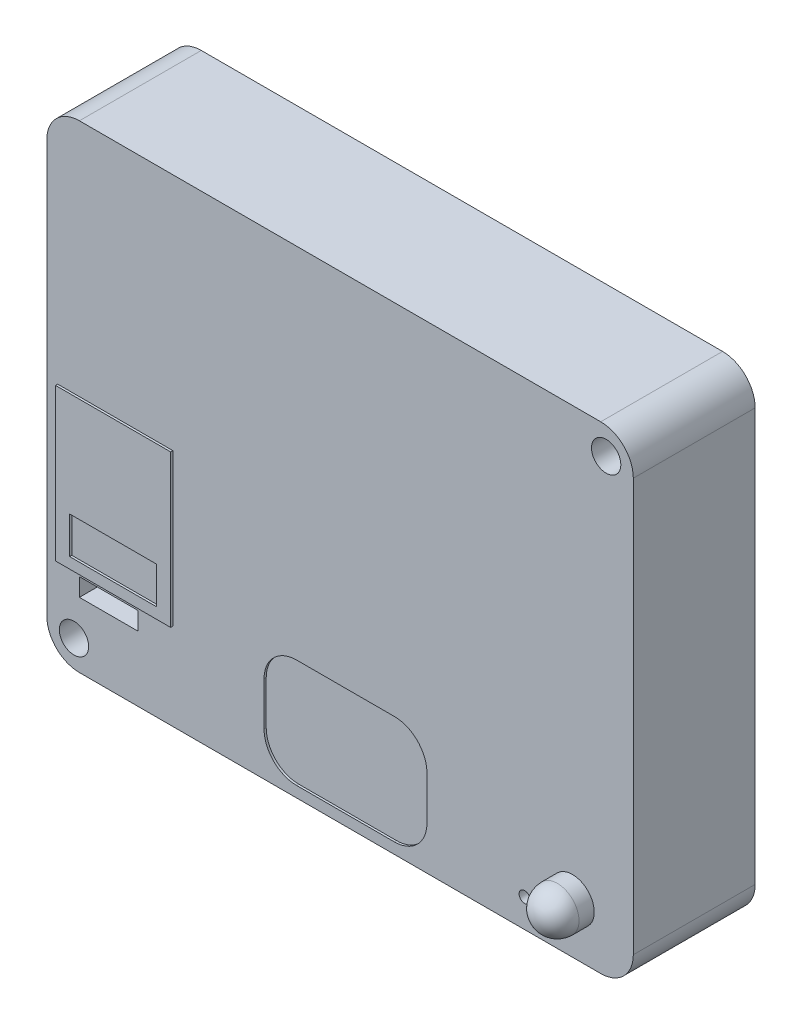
SolidWorks part; units mm, degrees
ref_plane "Front" through (0, 0, 0) normal (0, 0, 1) x (1, 0, 0)
ref_plane "Top" through (0, 0, 0) normal (0, 1, 0) x (1, 0, 0)
ref_plane "Right" through (0, 0, 0) normal (1, 0, 0) x (0, 0, -1)
sketch "Sketch1" plane through (0, 0, 0) normal (0, 0, 1) x (1, 0, 0)
  line L1 (-49.1448, -27.231) -> (19.4352, -27.231)
  line L2 (-49.1448, -27.231) -> (-49.1448, 28.649)
  line L3 (-49.1448, 28.649) -> (19.4352, 28.649)
  line L4 (19.4352, -27.231) -> (19.4352, 28.649)
  dimension "D1" = 68.58
  dimension "D2" = 55.88
extrude "Base-Extrude" add sketch "Sketch1" along normal blind 14.5034
sketch "Sketch2" plane through (0, 0, 14.5034) normal (0, 0, 1) x (1, 0, 0)
  line L0 (19.4352, -27.231) -> (19.4352, 28.649) construction
  line L1 (19.4352, 28.649) -> (-49.1448, 28.649) construction
  line L2 (-49.1448, -27.231) -> (19.4352, -27.231) construction
  line L3 (-49.1448, 28.649) -> (-49.1448, -27.231) construction
  circle A0 centre (16.2602, 25.474) radius 1.7145
  circle A1 centre (-45.9698, -24.056) radius 1.7145
  dimension "D5" = 3.429
  dimension "D6" = 3.429
  dimension "D1" = 3.175
  dimension "D2" = 3.175
  dimension "D3" = 3.175
  dimension "D4" = 3.175
extrude "Cut-Extrude1" cut sketch "Sketch2" against normal up to vertex
sketch "Sketch3" plane through (0, 0, 14.5034) normal (0, 0, 1) x (1, 0, 0)
  line L0 (-49.1448, -27.231) -> (19.4352, -27.231) construction
  line L1 (-23.7448, -13.261) -> (-4.6948, -13.261)
  line L2 (-23.7448, -13.261) -> (-23.7448, -25.961)
  line L3 (-23.7448, -25.961) -> (-4.6948, -25.961)
  line L4 (-4.6948, -13.261) -> (-4.6948, -25.961)
  line L5 (19.4352, -27.231) -> (19.4352, 28.649) construction
  dimension "D1" = 19.05
  dimension "D2" = 12.7
  dimension "D3" = 1.27
  dimension "D4" = 24.13
extrude "Cut-Extrude2" cut sketch "Sketch3" against normal blind 0.508
sketch "Sketch4" plane through (0, 0, 14.5034) normal (0, 0, 1) x (1, 0, 0)
  line L0 (-49.1448, -27.231) -> (19.4352, -27.231) construction
  line L1 (19.4352, -27.231) -> (19.4352, 28.649) construction
  circle A0 centre (6.7352, -23.929) radius 0.6553
  dimension "D1" = 3.302
  dimension "D2" = 12.7
extrude "Cut-Extrude3" cut sketch "Sketch4" against normal blind 6.35
sketch "Sketch5" plane through (0, 0, 14.5034) normal (0, 0, 1) x (1, 0, 0)
  line L0 (-49.1448, 28.649) -> (-49.1448, -27.231) construction
  line L1 (-45.3348, -17.5155) -> (-38.4768, -17.5155)
  line L2 (-45.3348, -17.5155) -> (-45.3348, -19.611)
  line L3 (-45.3348, -19.611) -> (-38.4768, -19.611)
  line L4 (-38.4768, -17.5155) -> (-38.4768, -19.611)
  line L5 (-49.1448, -27.231) -> (19.4352, -27.231) construction
  dimension "D1" = 3.81
  dimension "D2" = 6.858
  dimension "D3" = 2.0955
  dimension "D4" = 7.62
extrude "Cut-Extrude4" cut sketch "Sketch5" against normal blind 6.35
fillet "Fillet1" radius 3.81
chamfer "Chamfer3" distance 0.254 angle 45
fillet "Fillet12" radius 3.81
fillet "Fillet13" radius 3.81
fillet "Fillet14" radius 3.81
fillet "Fillet15" radius 3.81
sketch "Sketch6" plane through (0, 0, 14.5034) normal (0, 0, 1) x (1, 0, 0)
  line L0 (-49.1448, -23.421) -> (-49.1448, 24.839) construction
  line L1 (-47.8748, -17.071) -> (-34.4128, -17.071)
  line L2 (-47.8748, -17.071) -> (-47.8748, 0.709)
  line L3 (-47.8748, 0.709) -> (-34.4128, 0.709)
  line L4 (-34.4128, -17.071) -> (-34.4128, 0.709)
  line L5 (15.6252, -27.231) -> (-45.3348, -27.231) construction
  line L6 (-46.2238, -15.801) -> (-36.0638, -15.801)
  line L7 (-46.2238, -15.801) -> (-46.2238, -11.483)
  line L8 (-46.2238, -11.483) -> (-36.0638, -11.483)
  line L9 (-36.0638, -15.801) -> (-36.0638, -11.483)
  line L10 (-41.1438, 6.1023) -> (-41.1438, -22.1922) construction
  dimension "D1" = 13.462
  dimension "D2" = 17.78
  dimension "D3" = 1.27
  dimension "D4" = 10.16
  dimension "D5" = 10.16
  dimension "D6" = 4.318
  dimension "D9" = 1.27
extrude "Cut-Extrude5" cut sketch "Sketch6" against normal blind 0.254 flip side to cut
sketch "Sketch7" plane through (0, 0, 14.2494) normal (0, 0, 1) x (1, 0, 0)
  line L0 (19.4352, 24.839) -> (19.4352, -23.421) construction
  line L1 (15.6252, -27.231) -> (-45.3348, -27.231) construction
  circle A0 centre (12.3232, -21.389) radius 2.54
  dimension "D1" = 7.112
  dimension "D2" = 5.842
extrude "Boss-Extrude1" add sketch "Sketch7" along normal blind 1.778
dome "Dome1" faces to dome 1 distance 2.54 parameters "D1"=2.54
